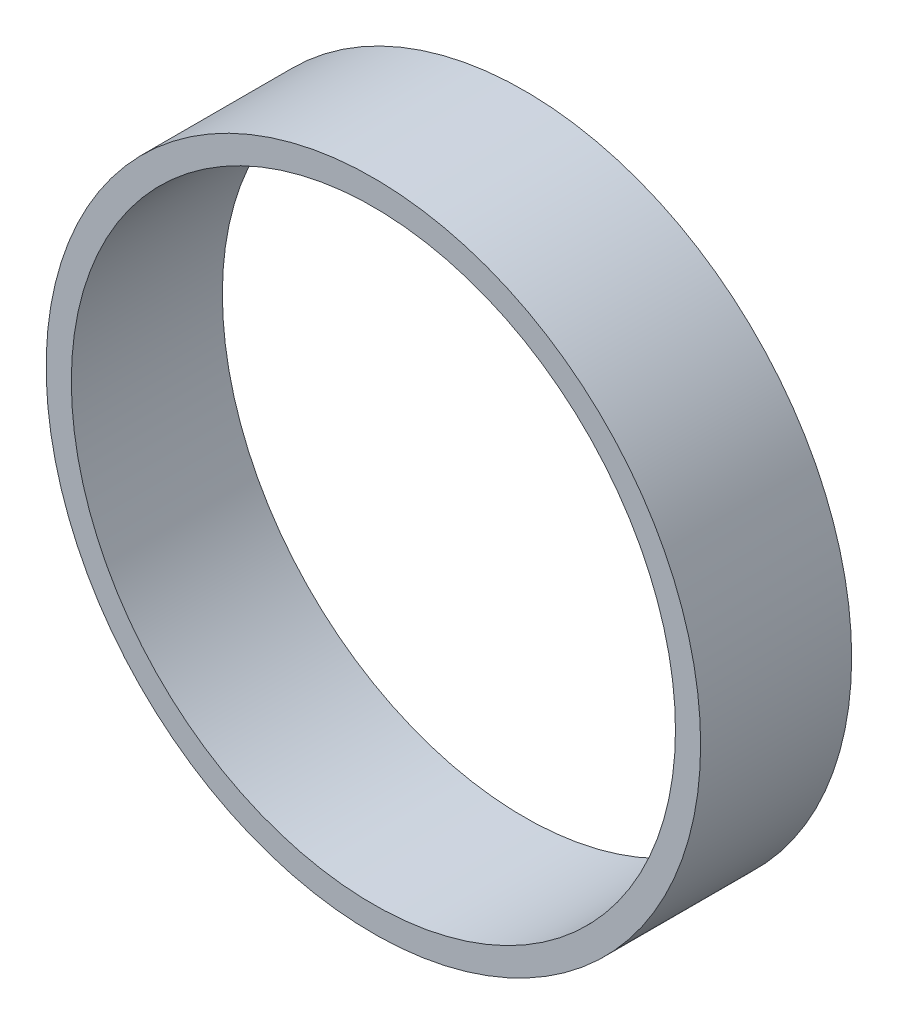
SolidWorks part; units mm, degrees
ref_plane "Plan de face" through (0, 0, 0) normal (0, 0, 1) x (1, 0, 0)
ref_plane "Plan de dessus" through (0, 0, 0) normal (0, 1, 0) x (1, 0, 0)
ref_plane "Plan de droite" through (0, 0, 0) normal (1, 0, 0) x (0, 0, -1)
sketch "Esquisse1" plane through (0, 0, 0) normal (0, 0, 1) x (1, 0, 0)
  circle A0 centre (0, 0) radius 30
  circle A1 centre (0, 0) radius 32.5
  dimension "D1" = 60
  dimension "D2" = 65
extrude "Extrusion1" add sketch "Esquisse1" along normal blind 15
